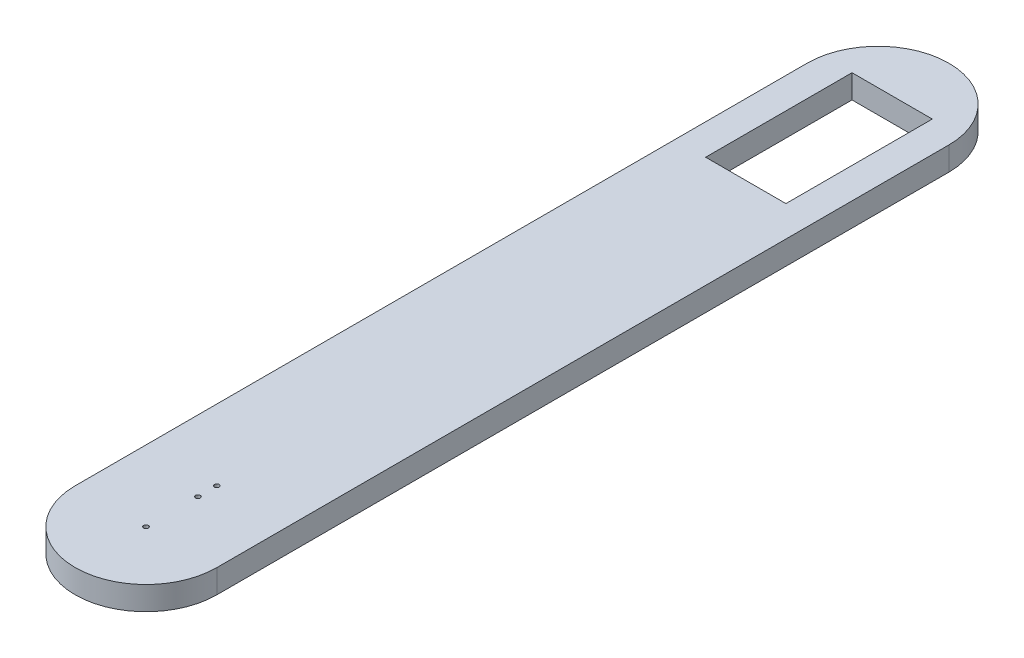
SolidWorks part; units mm, degrees
ref_plane "Front Plane" through (0, 0, 0) normal (0, 0, 1) x (1, 0, 0)
ref_plane "Top Plane" through (0, 0, 0) normal (0, 1, 0) x (1, 0, 0)
ref_plane "Right Plane" through (0, 0, 0) normal (1, 0, 0) x (0, 0, -1)
sketch "Sketch1" plane through (0, 0, 0) normal (0, 1, 0) x (1, 0, 0)
  line L0 (0, 0) -> (0, 155)
  line L1 (30, 0) -> (30, 155)
  arc A0 (0, 0) -> (30, 0) centre (15, 0) ccw
  arc A2 (30, 155) -> (0, 155) centre (15, 155) ccw
  dimension "D1" = 155
  dimension "D2" = 30
extrude "Boss-Extrude1" add sketch "Sketch1" along normal blind 5 contours L1 A2 L0 A0
sketch "Sketch2" plane through (0, 5, 0) normal (0, 1, 0) x (1, 0, 0)
  circle A0 centre (15, 11) radius 0.5
  circle A1 centre (15, 15) radius 0.5
  circle A5 centre (15, 0) radius 0.5
  arc A6 (0, 0) -> (30, 0) centre (15, 0) ccw construction
  dimension "D4" = 1
  dimension "D5" = 1
  dimension "D11" = 1
  dimension "D6" = 4
  dimension "D9" = 11
extrude "Cut-Extrude1" cut sketch "Sketch2" against normal blind 10
sketch "Sketch3" plane through (0, 5, 0) normal (0, 1, 0) x (1, 0, 0)
  line L0 (6.5, 158) -> (23.5, 158)
  line L1 (23.5, 158) -> (23.5, 127)
  line L2 (23.5, 127) -> (6.5, 127)
  line L3 (6.5, 127) -> (6.5, 158)
  line L4 (0, 0) -> (0, 155) construction
  dimension "D1" = 3
  dimension "D2" = 6.5
  dimension "D3" = 17
  dimension "D4" = 31
extrude "Cut-Extrude2" cut sketch "Sketch3" against normal through all
